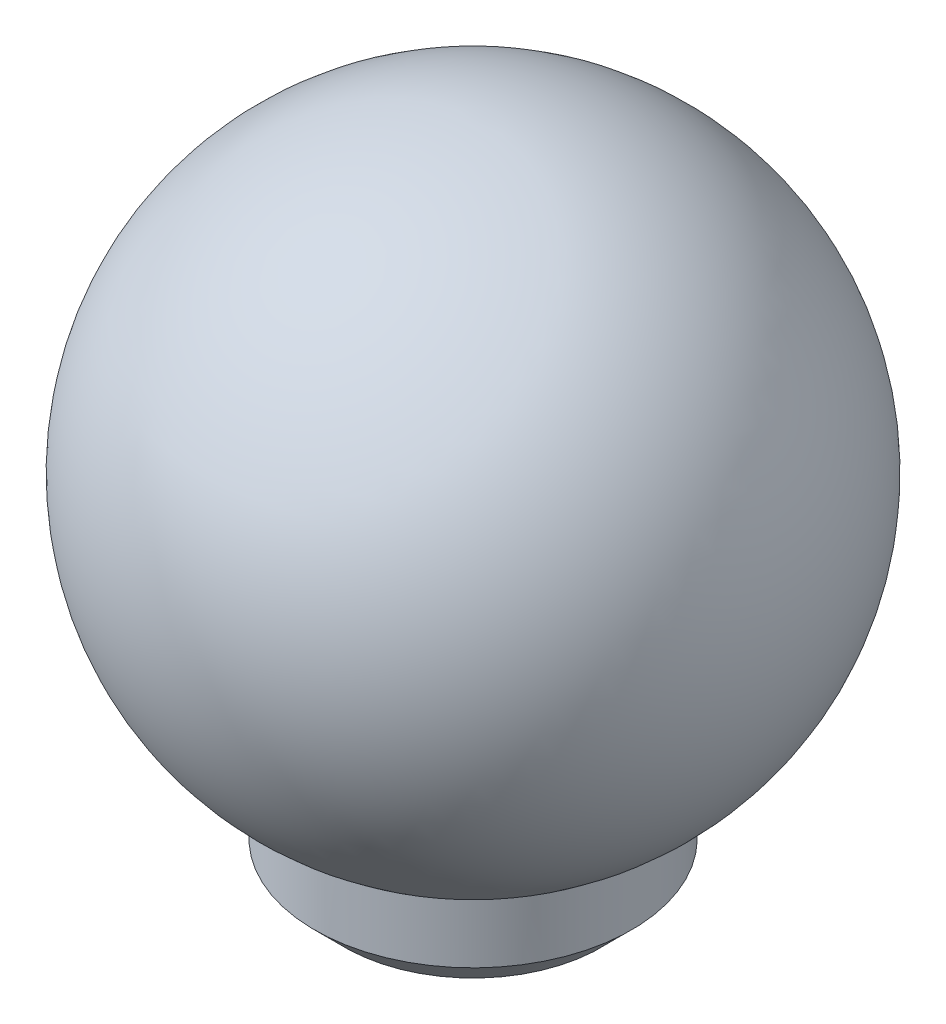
SolidWorks part; units mm, degrees
ref_plane "Front Plane" through (0, 0, 0) normal (0, 0, 1) x (1, 0, 0)
ref_plane "Top Plane" through (0, 0, 0) normal (0, 1, 0) x (1, 0, 0)
ref_plane "Right Plane" through (0, 0, 0) normal (1, 0, 0) x (0, 0, -1)
sketch "Sketch1" plane through (0, 0, 0) normal (0, 0, 1) x (1, 0, 0)
  line L0 (0, 0) -> (0, -25.4) construction
  line L1 (0, -12.7) -> (0, -82.55) construction
  line L2 (0, -82.55) -> (25.4, -82.55) construction
  line L3 (0, -12.7) -> (13.335, -12.7) construction
  line L4 (25.4, -82.55) -> (13.335, -12.7) construction
  line L5 (-3.81, -95.1738) -> (3.81, -95.1738) construction
  line L6 (11.7891, -94.5176) -> (0, 95.25) construction
  line L7 (0, 0) -> (11.7891, -94.5176) construction
  line L8 (6.6675, -12.7) -> (6.6675, -10.809) construction
  line L9 (0, -25.4) -> (15.5286, -25.4) construction
  line L10 (10.113, -12.7) -> (22.178, -82.55) construction
  line L11 (13.335, -12.7) -> (6.6675, -10.809) construction
  line L12 (0, -12.7) -> (10.6339, -15.7159) construction
  line L13 (6.6675, -10.809) -> (6.6675, -14.591) construction
  line L14 (6.6675, -14.591) -> (0, -14.591) construction
  line L15 (3.81, -95.1738) -> (3.81, -88.1137) construction
  line L16 (3.81, -88.1137) -> (19.685, -88.1137) construction
  line L17 (19.685, -88.1137) -> (19.685, -93.1937) construction
  line L18 (15.2087, -88.1137) -> (11.3126, -25.4) construction
  line L19 (12.0873, -24.13) -> (0, -24.13) construction
  circle A0 centre (0, 0) radius 95.25 construction
  circle A1 centre (0, 0) radius 12.7 construction
  circle A2 centre (0, -25.4) radius 69.85 construction
  arc A3 (3.81, -95.1738) -> (19.685, -93.1937) centre (0, 0) ccw construction
  circle A4 centre (7.4953, -25.4) radius 4.7411 construction
  point P29 (12.2364, -25.4)
  dimension "D1" = 190.5
  dimension "D3" = 25.4
  dimension "D8" = 15.875
  dimension "D2" = 25.4
  dimension "D4" = 69.85
  dimension "D5" = 50.8
  dimension "D6" = 26.67
  dimension "D7" = 7.62
  dimension "D9" = 7.11
  dimension "D10" = 3.175
  dimension "D11" = 5.08
  dimension "D12" = 2.54
  dimension "D13" = 7.62
sketch "Sketch2" plane through (0, 0, 0) normal (0, 0, 1) x (1, 0, 0)
  line L0 (0, 0) -> (0, -25.4) construction
  line L1 (0, -12.7) -> (0, -82.55) construction
  line L2 (0, -82.55) -> (25.4, -82.55) construction
  line L3 (0, -12.7) -> (13.335, -12.7) construction
  line L4 (25.4, -82.55) -> (13.335, -12.7) construction
  line L5 (-3.81, -95.1738) -> (3.81, -95.1738) construction
  line L6 (11.7891, -94.5176) -> (0, 95.25) construction
  line L7 (0, 0) -> (11.7891, -94.5176) construction
  line L8 (6.6675, -12.7) -> (6.6675, -10.809) construction
  line L9 (0, -25.4) -> (15.5286, -25.4) construction
  line L10 (10.113, -12.7) -> (22.178, -82.55) construction
  line L11 (13.335, -12.7) -> (6.6675, -10.809) construction
  line L12 (0, -12.7) -> (10.6339, -15.7159) construction
  line L13 (6.6675, -10.809) -> (6.6675, -14.591) construction
  line L14 (6.6675, -14.591) -> (0, -14.591) construction
  line L15 (3.81, -95.1738) -> (3.81, -88.1137) construction
  line L16 (3.81, -88.1137) -> (19.685, -88.1137) construction
  line L17 (19.685, -88.1137) -> (19.685, -93.1937) construction
  line L18 (15.2087, -88.1137) -> (11.3126, -25.4) construction
  line L19 (12.0873, -24.13) -> (0, -24.13) construction
  line L20 (6.6675, -10.809) -> (6.6675, -14.591)
  line L21 (6.6675, -14.591) -> (0, -14.591)
  line L22 (0, 12.7) -> (0, -14.591)
  circle A0 centre (0, 0) radius 95.25 construction
  circle A1 centre (0, 0) radius 12.7 construction
  circle A2 centre (0, -25.4) radius 69.85 construction
  arc A3 (3.81, -95.1738) -> (19.685, -93.1937) centre (0, 0) ccw construction
  circle A4 centre (7.4953, -25.4) radius 4.7411 construction
  arc A5 (0, 12.7) -> (6.6675, -10.809) centre (0, 0) cw
  point P29 (12.2364, -25.4)
  dimension "D1" = 190.5
  dimension "D3" = 25.4
  dimension "D8" = 15.875
  dimension "D2" = 25.4
  dimension "D4" = 69.85
  dimension "D5" = 50.8
  dimension "D6" = 26.67
  dimension "D7" = 7.62
  dimension "D9" = 7.11
  dimension "D10" = 3.175
  dimension "D11" = 5.08
  dimension "D12" = 2.54
  dimension "D13" = 7.62
revolve "Revolve1" add sketch "Sketch2" angle 360 about L1
chamfer "Chamfer1" distance 1.27 angle 45 1 edges at (-6.6675, -14.591, 0)
